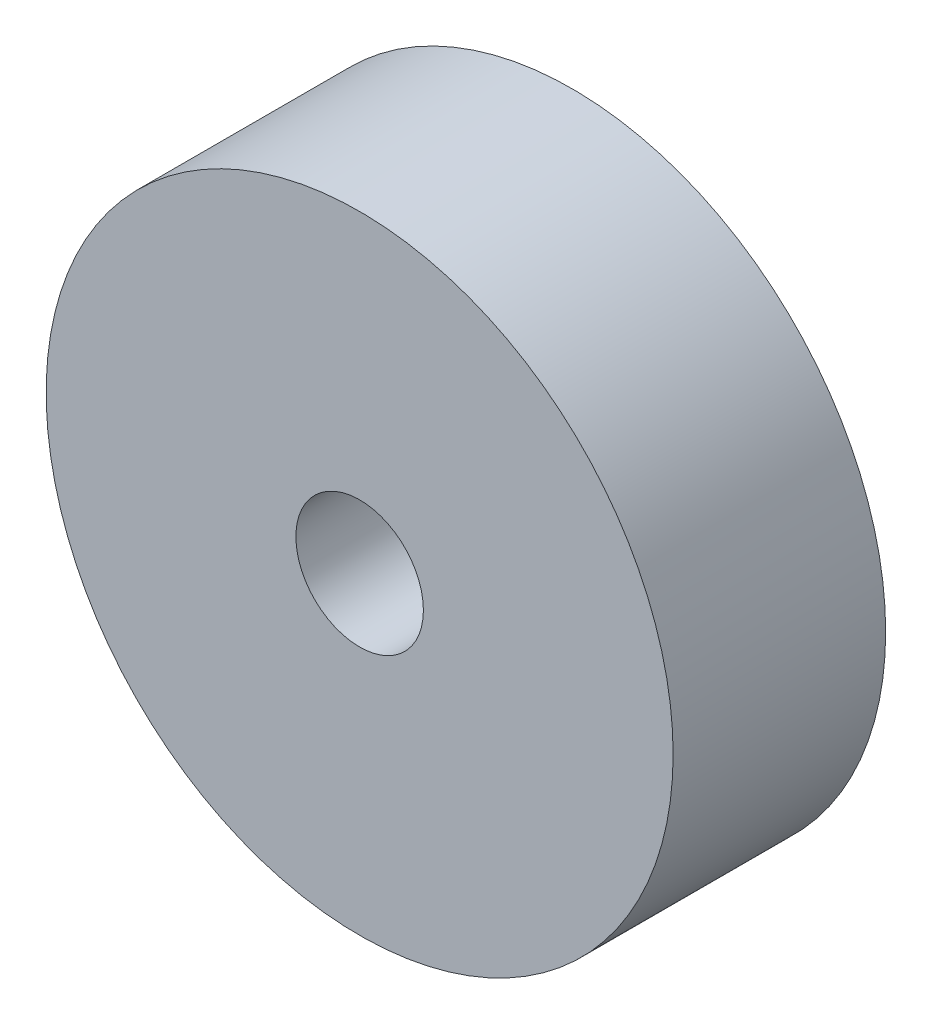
SolidWorks part; units mm, degrees
ref_plane "Plan de face" through (0, 0, 0) normal (0, 0, 1) x (1, 0, 0)
ref_plane "Plan de dessus" through (0, 0, 0) normal (0, 1, 0) x (1, 0, 0)
ref_plane "Plan de droite" through (0, 0, 0) normal (1, 0, 0) x (0, 0, -1)
sketch "Esquisse1" plane through (0, 0, 0) normal (0, 0, 1) x (1, 0, 0)
  circle A0 centre (0, 0) radius 3
  circle A1 centre (0, 0) radius 14.75
  dimension "D1" = 6
  dimension "D2" = 29.5
extrude "Boss.-Extru.1" add sketch "Esquisse1" along normal blind 10
